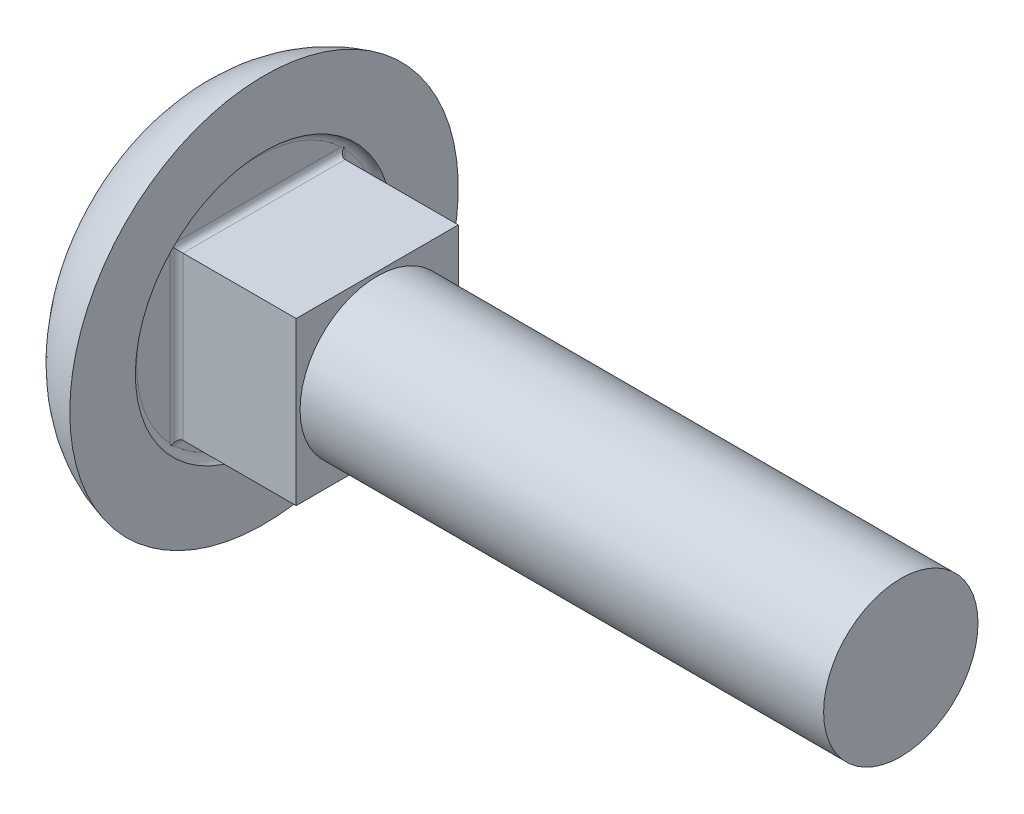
SolidWorks part; units mm, degrees
ref_plane "Front" through (0, 0, 0) normal (0, 0, 1) x (1, 0, 0)
ref_plane "Top" through (0, 0, 0) normal (0, 1, 0) x (1, 0, 0)
ref_plane "Right" through (0, 0, 0) normal (1, 0, 0) x (0, 0, -1)
sketch "Sketch1" plane through (0, 0, 0) normal (0, 0, 1) x (1, 0, 0)
  line L0 (-17.7731, 0) -> (33.4439, 0) construction
  line L1 (3.98, 7.55) -> (3.98, 0)
  line L2 (3.98, 0) -> (0, 0)
  arc A0 (0, 0) -> (0.8068, 4.684) centre (14, 0) cw
  arc A1 (0.8068, 4.684) -> (3.98, 7.55) centre (5.0475, 3.1784) cw
  dimension "R1" = 4.5
  dimension "r" = 14
  dimension "k" = 3.98
  dimension "dk" = 15.1
revolve "BaseHead" add sketch "Sketch1" angle 360 about L0
sketch "Sketch2" plane through (3.98, 0, 0) normal (1, 0, 0) x (0, 0, -1)
  circle A0 centre (0, 0) radius 5
  dimension "d1" = 10
extrude "Cut-Extrude1" cut sketch "Sketch2" against normal blind 0.25
ref_plane "Plan1" through (8.38, 0, 0) normal (1, 0, 0) x (0, 0, -1)
sketch "Sketch3" plane through (8.38, 0, 0) normal (1, 0, 0) x (0, 0, -1)
  line L1 (3.15, -3.15) -> (3.15, 3.15)
  line L2 (3.15, 3.15) -> (-3.15, 3.15)
  line L3 (-3.15, 3.15) -> (-3.15, -3.15)
  line L4 (-3.15, -3.15) -> (3.15, -3.15)
  circle A0 centre (0, 0) radius 3.15 construction
  dimension "Ss" = 6.3
extrude "Neck" add sketch "Sketch3" against normal up to next
fillet "Fillet" radius 0.25 4 edges at (3.73, -3.15, 0) (3.73, 0, 3.15) (3.73, 3.15, 0) (3.73, 0, -3.15)
sketch "Sketch4" plane through (3.73, 0, 0) normal (1, 0, 0) x (0, 0, -1)
  circle A0 centre (0, 0) radius 3
  dimension "d" = 6
extrude "BaseBody" add sketch "Sketch4" along normal blind 25
fillet "HeadFillet" radius 0.3 1 edges at (3.73, 0, -5)
sketch "Sketch5" plane through (0, 0, 0) normal (0, 0, 1) x (1, 0, 0)
  line L0 (28.4592, 3.2) -> (29.0008, 3.2)
  line L1 (29.0008, 3.2) -> (29.0008, 3)
  line L2 (29.0008, 3) -> (28.73, 2.531)
  line L3 (28.4592, 3) -> (28.73, 2.531)
  line L4 (28.4592, 3.2) -> (28.4592, 3)
  line L5 (28.73, 0) -> (0, 0) construction
  line L6 (28.4592, 3) -> (29.0008, 3) construction
  line L7 (28.73, 3) -> (28.73, 2.531) construction
  line L8 (28.73, 3) -> (8.38, 3) construction
  line L9 (28.73, -3) -> (28.73, 3) construction
  point P5 (28.73, 3.2)
  dimension "D1" = 0.2
  dimension "D2" = 0.5415
revolve "Cut-Revolve10" [suppressed] cut sketch "Sketch5" angle 360 about L5
pattern_linear "LPattern10" [suppressed] count 28 spacing 0.6498
equation "\"D2@Sketch5\" = (  \"d@Sketch4\" - \"D2@ThreadCosmetic1\" )  / 2"
equation "\"D3@LPattern10\" = \"D2@Sketch5\" * 1.2"
equation "\"D1@LPattern10\" = \"b@ThreadCosmetic1\" / \"D3@LPattern10\""
